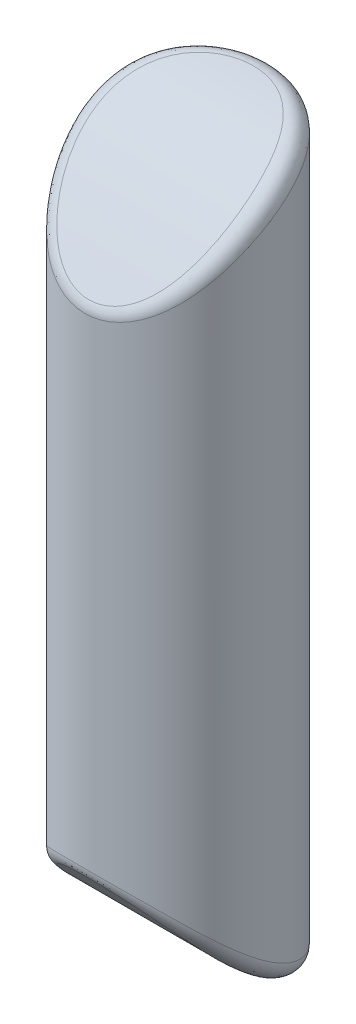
SolidWorks part; units mm, degrees
ref_plane "前视基准面" through (0, 0, 0) normal (0, 0, 1) x (1, 0, 0)
ref_plane "上视基准面" through (0, 0, 0) normal (0, 1, 0) x (1, 0, 0)
ref_plane "右视基准面" through (0, 0, 0) normal (1, 0, 0) x (0, 0, -1)
other "Configuration Table"
sketch "草图1" plane through (0, 0, 0) normal (0, 1, 0) x (1, 0, 0)
  circle A0 centre (0, 0) radius 60
  dimension "D1" = 120
extrude "凸台-拉伸1" add sketch "草图1" along normal mid plane 480
sketch "草图3" plane through (0, 0, 0) normal (1, 0, 0) x (0, 0, -1)
  line L0 (-60, 240) -> (-60, 158.8738)
  line L2 (60, 240) -> (-60, 240)
  line L3 (-60, 240) -> (-60, -240) construction
  line L4 (0, 0) -> (193.7191, 0) construction
  line L5 (60, 0) -> (60, -47.2658)
  line L6 (60, -240) -> (-60, -240)
  line L7 (60, 0) -> (60, -240)
  line L8 (-60, -158.8738) -> (-60, -240)
  spline S0 degree 3 poles (60, 240) (3.9476, 239.0924) (-27.9384, 195.7862) (-60, 158.8738) knots 0 0 0 0 1 1 1 1
  spline S1 degree 3 poles (60, -240) (3.9476, -239.0924) (-27.9384, -195.7862) (-60, -158.8738) knots 0 0 0 0 1 1 1 1
extrude "切除-拉伸1" cut sketch "草图3" against normal through all and the other way through all contours S0 L2 L0 | L6 S1 L8
fillet "圆角1" radius 10 2 edges at (10.6061, -159.9634, 59.0551) (10.6061, 159.9634, 59.0551)
